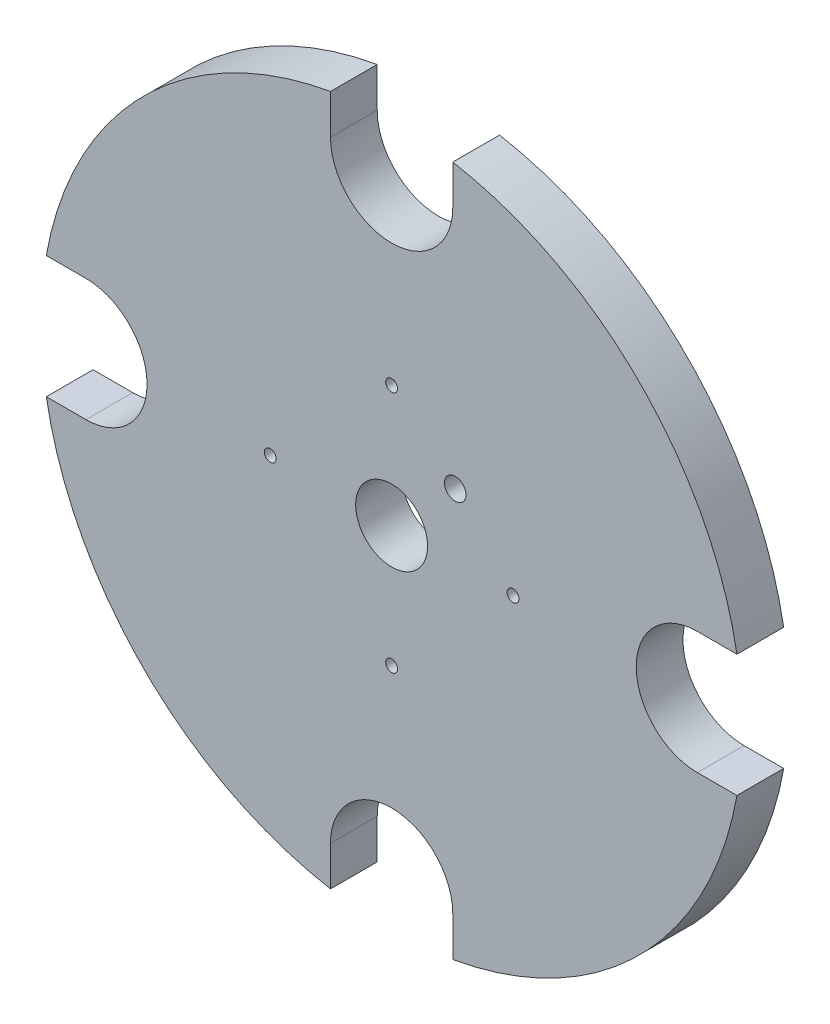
SolidWorks part; units mm, degrees
ref_plane "Plan1" through (0, 0, 0) normal (0, 0, 1) x (1, 0, 0)
ref_plane "Plan2" through (0, 0, 0) normal (0, 1, 0) x (1, 0, 0)
ref_plane "Plan3" through (0, 0, 0) normal (1, 0, 0) x (0, 0, -1)
sketch "Esquisse1" plane through (0, 0, 0) normal (0, 0, 1) x (1, 0, 0)
  circle A0 centre (0, 0) radius 195
  circle A1 centre (0, 0) radius 20
  dimension "D1" = 390
  dimension "D2" = 40
extrude "Base-Extrusion" add sketch "Esquisse1" along normal blind 26
sketch "Esquisse2" plane through (0, 0, 26) normal (0, 0, 1) x (1, 0, 0)
  line L0 (170, 34) -> (192.013, 34)
  line L1 (170, -34) -> (192.013, -34)
  line L2 (34, -170) -> (34, -192.013)
  line L3 (-34, -170) -> (-34, -192.013)
  line L4 (-170, -34) -> (-192.013, -34)
  line L5 (-170, 34) -> (-192.013, 34)
  line L6 (-34, 170) -> (-34, 192.013)
  line L7 (34, 170) -> (34, 192.013)
  arc A0 (170, 34) -> (170, -34) centre (170, 0) ccw
  circle A1 centre (0, 0) radius 20 construction
  arc A2 (192.013, -34) -> (192.013, 34) centre (0, 0) ccw
  circle A3 centre (0, 0) radius 195 construction
  arc A4 (34, -170) -> (-34, -170) centre (0, -170) ccw
  arc A5 (-34, -192.013) -> (34, -192.013) centre (0, 0) ccw
  arc A6 (-170, -34) -> (-170, 34) centre (-170, 0) ccw
  arc A7 (-192.013, 34) -> (-192.013, -34) centre (0, 0) ccw
  arc A8 (-34, 170) -> (34, 170) centre (0, 170) ccw
  arc A9 (34, 192.013) -> (-34, 192.013) centre (0, 0) ccw
  dimension "D1" = 68
  dimension "D2" = 170
extrude "Enlèv. mat.-Extru.1" cut sketch "Esquisse2" against normal through all
hole_wizard "Perçage1" positions "Esquisse4" profile "Esquisse3" hole size "M6" standard "ISO"
sketch "Esquisse4" plane through (0, 0, 26) normal (0, 0, 1) x (1, 0, 0)
  circle A0 centre (0, 0) radius 20 construction
  point P0 (0, 67.5)
  point P1 (67.5, 0)
  point P2 (0, -67.5)
  point P3 (-67.5, 0)
  dimension "D1" = 67.5
  dimension "D2" = 67.5
  dimension "D3" = 67.5
  dimension "D4" = 67.5
sketch "Esquisse3" plane through (0, 67.5, 26) normal (1, 0, 0) x (0, -1, 0)
  line L0 (0, 0) -> (0, 26)
  line L1 (0, 26) -> (3.3, 26)
  line L2 (3.3, 26) -> (3.3, 0)
  line L5 (3.3, 0) -> (0, 0)
  line L11 (0, -6.35) -> (0, 107.95) construction
  dimension "Diamètre du perçage jusqu'au prochain" = 6.6
  dimension "Profondeur du perçage jusqu'au prochain" = 26
sketch "Esquisse5" plane through (0, 0, 26) normal (0, 0, 1) x (1, 0, 0)
  line L0 (0, 0) -> (55.174, 55.174) construction
  circle A0 centre (35.3553, 35.3553) radius 6
  circle A4 centre (0, 0) radius 20 construction
  dimension "D1" = 50
  dimension "D2" = 12
extrude "Enlèv. mat.-Extru.2" cut sketch "Esquisse5" against normal through all
sketch "Esquisse6" plane through (0, 0, 0) normal (0, 0, -1) x (-1, 0, 0)
  circle A0 centre (-35.3553, 35.3553) radius 18
  circle A1 centre (-35.3553, 35.3553) radius 6 construction
  dimension "D1" = 36
extrude "Enlèv. mat.-Extru.3" cut sketch "Esquisse6" against normal blind 14
